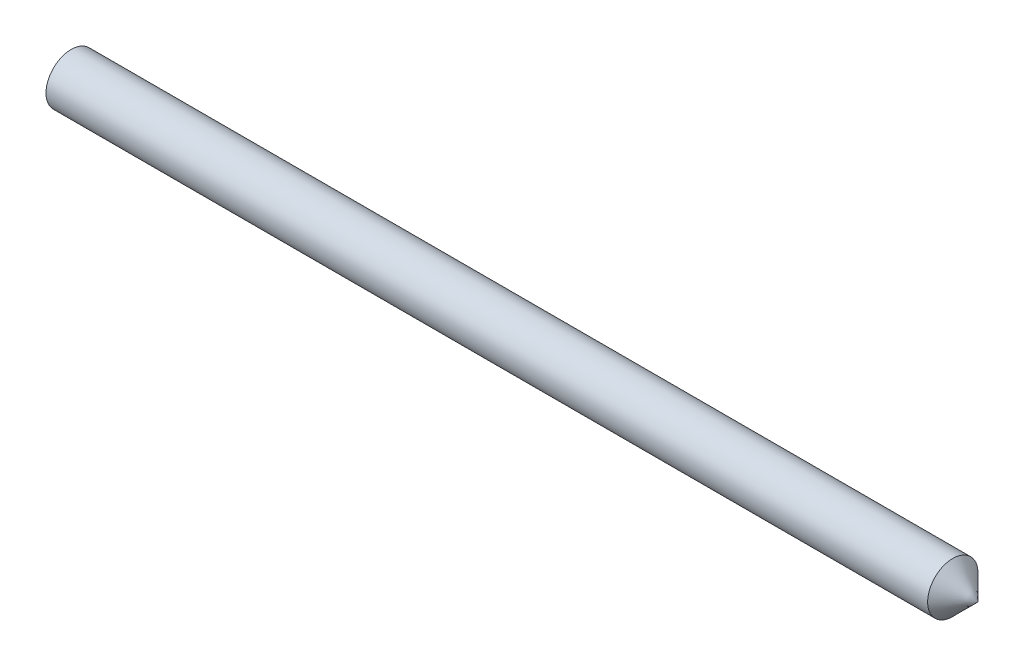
SolidWorks part; units mm, degrees
ref_plane "Front Plane" through (0, 0, 0) normal (0, 0, 1) x (1, 0, 0)
ref_plane "Top Plane" through (0, 0, 0) normal (0, 1, 0) x (1, 0, 0)
ref_plane "Right Plane" through (0, 0, 0) normal (1, 0, 0) x (0, 0, -1)
sketch "Sketch1" plane through (0, 0, 0) normal (0, 0, 1) x (1, 0, 0)
  line L0 (80.01, 0) -> (77.7875, 2.2225)
  line L1 (0, 0) -> (80.01, 0)
  line L2 (0, 0) -> (0, 2.2225)
  line L3 (0, 2.2225) -> (77.7875, 2.2225)
  dimension "D1" = 2.2225
  dimension "D2" = 80.01
revolve "Revolve1" add sketch "Sketch1" angle 360 about L1
